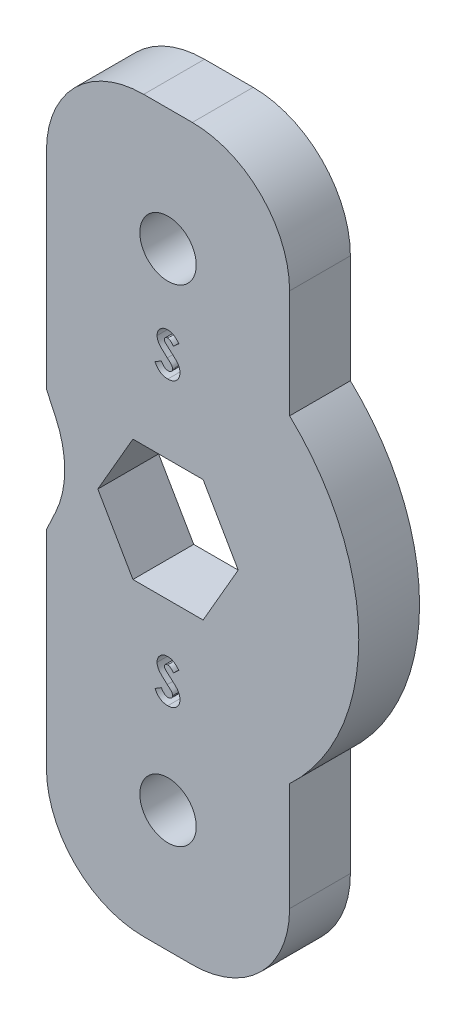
SolidWorks part; units mm, degrees
ref_plane "Front Plane" through (0, 0, 0) normal (0, 0, 1) x (1, 0, 0)
ref_plane "Top Plane" through (0, 0, 0) normal (0, 1, 0) x (1, 0, 0)
ref_plane "Right Plane" through (0, 0, 0) normal (1, 0, 0) x (0, 0, -1)
sketch "Sketch1" plane through (0, 0, 0) normal (0, 0, 1) x (1, 0, 0)
  line L1 (0, 38.1) -> (0, 22.225)
  line L3 (0, 38.1) -> (12.7, 38.1)
  line L4 (12.7, 0) -> (0, 0)
  line L5 (8.1831, 22.225) -> (4.5169, 22.225)
  line L6 (4.5169, 22.225) -> (2.6838, 19.05)
  line L7 (2.6838, 19.05) -> (4.5169, 15.875)
  line L8 (4.5169, 15.875) -> (8.1831, 15.875)
  line L9 (8.1831, 15.875) -> (10.0162, 19.05)
  line L10 (10.0162, 19.05) -> (8.1831, 22.225)
  line L11 (0, 22.225) -> (1.4799, 19.05)
  line L12 (1.4799, 19.05) -> (0, 15.875)
  line L13 (0, 15.875) -> (0, 0)
  line L14 (6.35, 38.1) -> (6.35, 0) construction
  line L15 (12.7, 15.875) -> (12.7, 0)
  line L16 (11.2201, 19.05) -> (12.7, 15.875)
  line L17 (12.7, 22.225) -> (11.2201, 19.05)
  line L18 (12.7, 38.1) -> (12.7, 22.225)
  circle A2 centre (6.35, 19.05) radius 3.175 construction
  point P7 (6.35, 38.1)
  dimension "D1" = 2.6838
  dimension "D7" = 6.35
  dimension "D3" = 12.7
  dimension "D5" = 19.05
extrude "Boss-Extrude1" add sketch "Sketch1" along normal blind 3.175
fillet "Fillet1" radius 5.08 6 edges at (1.4799, 19.05, 1.5875) (0, 0, 1.5875) (0, 38.1, 1.5875) (12.7, 0, 1.5875) (11.2201, 19.05, 1.5875) (12.7, 38.1, 1.5875)
hole_wizard "#4 Clearance Hole1" positions "Sketch3" profile "Sketch2" hole size "#4" standard "ANSI Inch"
sketch "Sketch3" plane through (0, 0, 0) normal (0, 0, -1) x (-1, 0, 0)
  line L11 (-12.7, 0) -> (0, 0)
  line L13 (0, 38.1) -> (-12.7, 38.1)
  line L15 (-12.7, 0) -> (0, 0)
  line L17 (0, 38.1) -> (-12.7, 38.1)
  line L30 (-8.1831, 15.875) -> (-4.5169, 15.875)
  line L31 (-10.0162, 19.05) -> (-8.1831, 15.875)
  line L32 (-8.1831, 22.225) -> (-10.0162, 19.05)
  line L33 (-4.5169, 22.225) -> (-8.1831, 22.225)
  line L34 (-2.6838, 19.05) -> (-4.5169, 22.225)
  line L35 (-4.5169, 15.875) -> (-2.6838, 19.05)
  line L36 (-8.1831, 15.875) -> (-4.5169, 15.875)
  line L37 (-10.0162, 19.05) -> (-8.1831, 15.875)
  line L38 (-8.1831, 22.225) -> (-10.0162, 19.05)
  line L39 (-4.5169, 22.225) -> (-8.1831, 22.225)
  line L40 (-2.6838, 19.05) -> (-4.5169, 22.225)
  line L41 (-4.5169, 15.875) -> (-2.6838, 19.05)
  line L79 (0, 0) -> (0, 15.875)
  line L80 (0, 0) -> (0, 15.875)
  line L81 (0, 15.875) -> (-1.4799, 19.05)
  line L82 (0, 15.875) -> (-1.4799, 19.05)
  line L83 (-1.4799, 19.05) -> (0, 22.225)
  line L84 (-1.4799, 19.05) -> (0, 22.225)
  line L85 (0, 22.225) -> (0, 38.1)
  line L86 (0, 22.225) -> (0, 38.1)
  line L97 (-12.7, 38.1) -> (-12.7, 22.225)
  line L98 (-12.7, 38.1) -> (-12.7, 22.225)
  line L99 (-12.7, 22.225) -> (-11.2201, 19.05)
  line L100 (-12.7, 22.225) -> (-11.2201, 19.05)
  line L101 (-11.2201, 19.05) -> (-12.7, 15.875)
  line L102 (-11.2201, 19.05) -> (-12.7, 15.875)
  line L103 (-12.7, 15.875) -> (-12.7, 0)
  line L104 (-12.7, 15.875) -> (-12.7, 0)
  point P0 (-6.35, 6.35)
  point P2 (-6.35, 31.75)
  dimension "D1" = 12.7
  dimension "D2" = 12.7
  dimension "D5" = 6.35
  dimension "D6" = 6.35
  dimension "D3" = 0
  dimension "D4" = 0
sketch "Sketch2" plane through (6.35, 6.35, 0) normal (1, 0, 0) x (0, 1, 0)
  line L0 (0, 0) -> (0, 3.175)
  line L1 (0, 3.175) -> (1.4732, 3.175)
  line L2 (1.4732, 3.175) -> (1.4732, 0)
  line L5 (1.4732, 0) -> (0, 0)
  line L11 (0, -6.35) -> (0, 107.95) construction
  dimension "Thru Hole Dia." = 2.9464
  dimension "Thru Hole Depth" = 3.175
sketch "Sketch4" plane through (0, 0, 3.175) normal (0, 0, 1) x (1, 0, 0)
  text T0 "<b>S</b>" font "Century Gothic" height in points 8
  text T1 "<b>S</b>" font "Century Gothic" height in points 8
  dimension "D1" = 0.762
extrude "Cut-Extrude1" cut sketch "Sketch4" against normal through all
sketch "Sketch5" plane through (0, 0, 0) normal (0, 0, 1) x (1, 0, 0)
  line L0 (11.0269, 28.6601) -> (11.0269, 9.4399)
  arc A0 (11.0269, 28.6601) -> (11.0269, 9.4399) centre (4.9334, 19.05) cw
  point P2 (11.0269, 19.05)
extrude "Boss-Extrude2" add sketch "Sketch5" along normal blind 3.175
